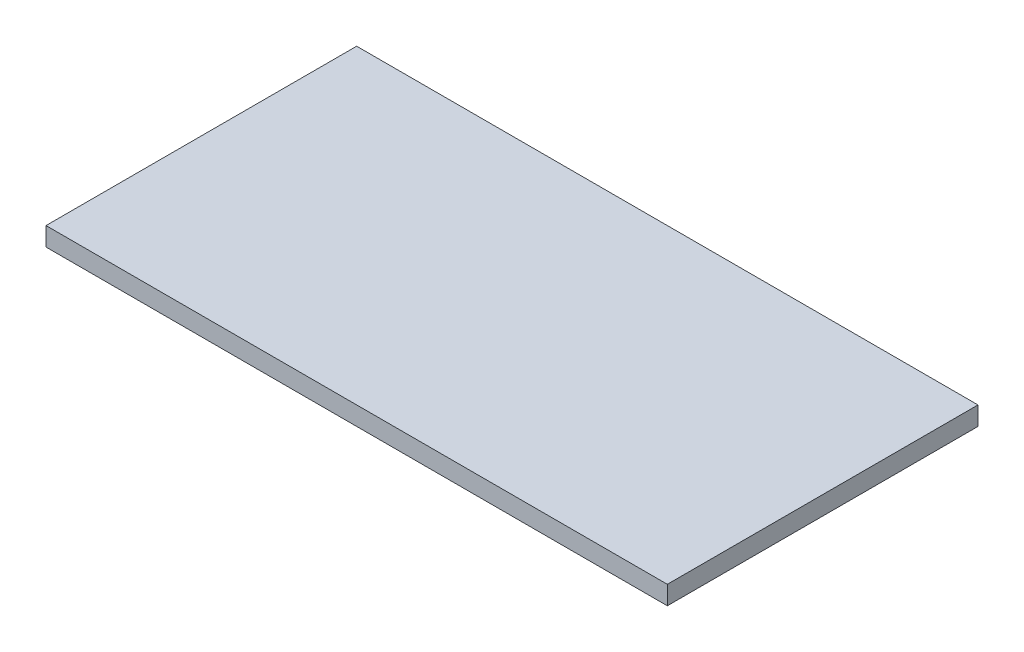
SolidWorks part; units mm, degrees
ref_plane "Plan de face" through (0, 0, 0) normal (0, 0, 1) x (1, 0, 0)
ref_plane "Plan de dessus" through (0, 0, 0) normal (0, 1, 0) x (1, 0, 0)
ref_plane "Plan de droite" through (0, 0, 0) normal (1, 0, 0) x (0, 0, -1)
sketch "Esquisse1" plane through (0, 0, 0) normal (0, 1, 0) x (1, 0, 0)
  line L1 (50, -25) -> (-50, -25)
  line L2 (50, -25) -> (50, 25)
  line L3 (50, 25) -> (-50, 25)
  line L4 (-50, -25) -> (-50, 25)
  line L5 (50, -25) -> (-50, 25) construction
  line L6 (50, 25) -> (-50, -25) construction
  point P0 (0, 0)
  dimension "D1" = 100
  dimension "D2" = 50
extrude "Boss.-Extru.1" add sketch "Esquisse1" along normal blind 3
